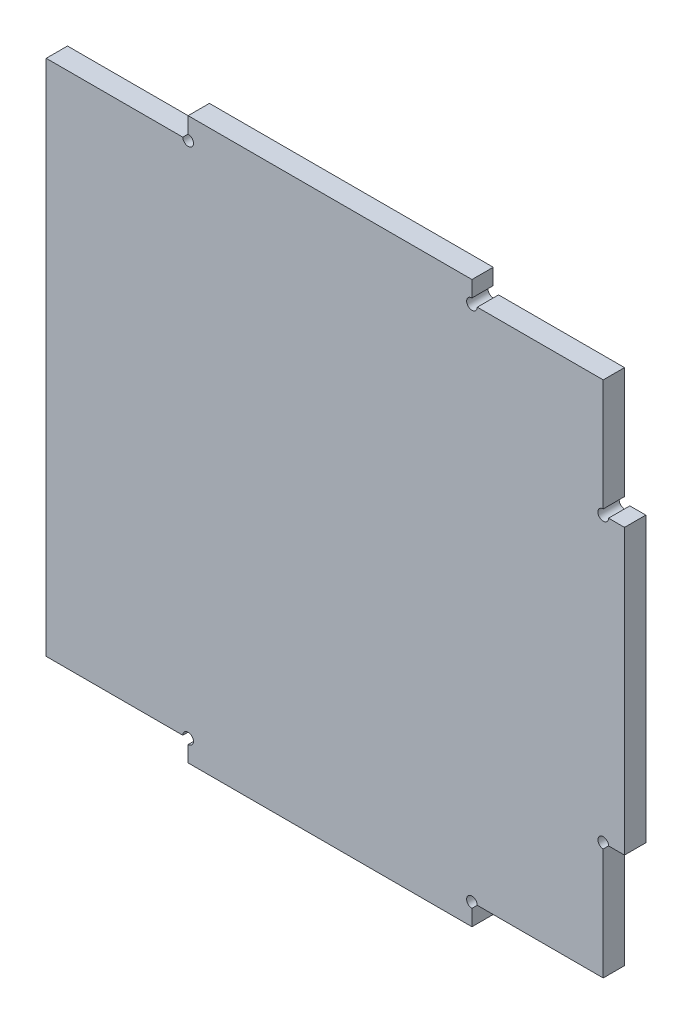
SolidWorks part; units mm, degrees
ref_plane "Plan de face" through (0, 0, 0) normal (0, 0, 1) x (1, 0, 0)
ref_plane "Plan de dessus" through (0, 0, 0) normal (0, 1, 0) x (1, 0, 0)
ref_plane "Plan de droite" through (0, 0, 0) normal (1, 0, 0) x (0, 0, -1)
sketch "Esquisse1" plane through (0, 0, 0) normal (0, 0, 1) x (1, 0, 0)
  line L0 (-97.6291, 142.2361) -> (-57.6291, 142.2361)
  line L1 (-57.6291, 142.2361) -> (-57.6291, 148.2361)
  line L2 (-57.6291, 148.2361) -> (22.3709, 148.2361)
  line L3 (22.3709, 148.2361) -> (22.3709, 142.2361)
  line L4 (22.3709, 142.2361) -> (59.3709, 142.2361)
  line L5 (59.3709, 142.2361) -> (59.3709, 109.2361)
  line L6 (59.3709, 109.2361) -> (65.3709, 109.2361)
  line L7 (65.3709, 109.2361) -> (65.3709, 29.2361)
  line L8 (65.3709, 29.2361) -> (59.3709, 29.2361)
  line L9 (59.3709, 29.2361) -> (59.3709, -3.7639)
  line L10 (59.3709, -3.7639) -> (22.3709, -3.7639)
  line L11 (22.3709, -3.7639) -> (22.3709, -9.7639)
  line L12 (22.3709, -9.7639) -> (-57.6291, -9.7639)
  line L13 (-57.6291, -9.7639) -> (-57.6291, -3.7639)
  line L14 (-57.6291, -3.7639) -> (-97.6291, -3.7639)
  line L15 (-97.6291, -3.7639) -> (-97.6291, 142.2361)
  dimension "D1" = 158
  dimension "D2" = 6
  dimension "D3" = 6
  dimension "D4" = 6
  dimension "D5" = 157
  dimension "D6" = 80
  dimension "D7" = 80
  dimension "D8" = 33
  dimension "D9" = 80
  dimension "D10" = 37
extrude "Boss.-Extru.1" add sketch "Esquisse1" along normal blind 6
sketch "Esquisse4" plane through (0, 0, 6) normal (0, 0, 1) x (1, 0, 0)
  circle A0 centre (-57.6291, 142.2361) radius 1.5
  circle A1 centre (22.3709, 142.2361) radius 1.5
  circle A2 centre (59.3709, 109.2361) radius 1.5
  circle A3 centre (59.3709, 29.2361) radius 1.5
  circle A4 centre (22.3709, -3.7639) radius 1.5
  circle A5 centre (-57.6291, -3.7639) radius 1.5
extrude "Enlèv. mat.-Extru.3" cut sketch "Esquisse4" against normal through all
